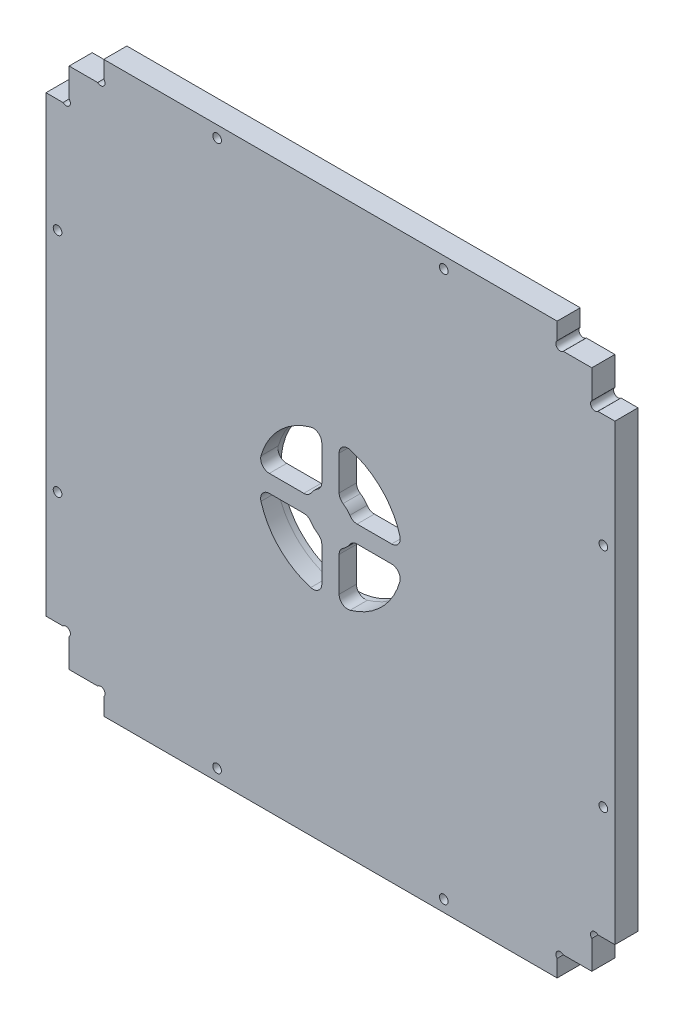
SolidWorks part; units mm, degrees
ref_plane "Plan de face" through (0, 0, 0) normal (0, 0, 1) x (1, 0, 0)
ref_plane "Plan de dessus" through (0, 0, 0) normal (0, 1, 0) x (1, 0, 0)
ref_plane "Plan de droite" through (0, 0, 0) normal (1, 0, 0) x (0, 0, -1)
sketch "Esquisse1" plane through (0, 0, 0) normal (0, 0, 1) x (1, 0, 0)
  line L0 (-102.032, 10.4842) -> (-102.032, -146.5158)
  line L1 (-279.032, 30.4842) -> (-229.032, 30.4842)
  line L2 (-299.032, -146.5158) -> (-299.032, 10.4842)
  line L3 (-279.032, -166.5158) -> (-229.032, -166.5158)
  line L4 (-299.032, -68.0158) -> (-291.032, 10.4842) construction
  line L6 (-299.032, -68.0158) -> (-291.032, -146.5158) construction
  line L7 (-122.032, 30.4842) -> (-122.032, 24.6055)
  line L8 (-102.032, -68.0158) -> (-110.032, 10.4842) construction
  line L9 (-119.9106, 22.4842) -> (-110.032, 22.4842)
  line L10 (-110.032, 22.4842) -> (-110.032, 12.6055)
  line L11 (-107.9106, 10.4842) -> (-102.032, 10.4842)
  line L12 (-279.032, 30.4842) -> (-279.032, 24.6055)
  line L13 (-281.1533, 22.4842) -> (-291.032, 22.4842)
  line L14 (-291.032, 22.4842) -> (-291.032, 12.6055)
  line L15 (-293.1533, 10.4842) -> (-299.032, 10.4842)
  line L16 (-299.032, -146.5158) -> (-293.1533, -146.5158)
  line L17 (-291.032, -148.6371) -> (-291.032, -158.5158)
  line L18 (-291.032, -158.5158) -> (-281.1533, -158.5158)
  line L19 (-279.032, -160.6371) -> (-279.032, -166.5158)
  line L20 (-122.032, -166.5158) -> (-122.032, -160.6371)
  line L21 (-119.9106, -158.5158) -> (-110.032, -158.5158)
  line L22 (-110.032, -158.5158) -> (-110.032, -148.6371)
  line L23 (-107.9106, -146.5158) -> (-102.032, -146.5158)
  line L24 (-102.032, -68.0158) -> (-110.032, -146.5158) construction
  line L25 (-299.032, -68.0158) -> (-102.032, -68.0158) construction
  line L26 (-200.532, -166.5158) -> (-122.032, -158.5158) construction
  line L27 (-200.532, -166.5158) -> (-279.032, -158.5158) construction
  line L28 (-200.532, 30.4842) -> (-122.032, 22.4842) construction
  line L29 (-200.532, 30.4842) -> (-279.032, 22.4842) construction
  line L30 (-279.032, 22.4842) -> (-292.5776, 36.0299) construction
  line L31 (-291.032, 10.4842) -> (-304.278, 23.7302) construction
  line L33 (-122.032, 22.4842) -> (-105.5635, 38.9527) construction
  line L34 (-110.032, 10.4842) -> (-87.3899, 33.1263) construction
  line L35 (-110.032, -146.5158) -> (-79.4717, -177.076) construction
  line L36 (-122.032, -158.5158) -> (-95.0538, -185.494) construction
  line L37 (-279.032, -158.5158) -> (-300.8456, -180.3295) construction
  line L38 (-291.032, -146.5158) -> (-319.2909, -174.7747) construction
  line L44 (-229.032, 30.4842) -> (-122.032, 30.4842)
  line L69 (-229.032, -166.5158) -> (-122.032, -166.5158)
  circle A0 centre (-239.782, 26.4842) radius 1.5
  circle A1 centre (-161.282, 26.4842) radius 1.5
  circle A2 centre (-106.032, -28.7658) radius 1.5
  circle A3 centre (-106.032, -107.2658) radius 1.5
  circle A4 centre (-161.282, -162.5158) radius 1.5
  circle A5 centre (-239.782, -162.5158) radius 1.5
  circle A6 centre (-295.032, -107.2658) radius 1.5
  circle A7 centre (-295.032, -28.7658) radius 1.5
  arc A8 (-281.1533, 22.4842) -> (-279.032, 24.6055) centre (-280.0926, 23.5449) ccw
  arc A9 (-293.1533, 10.4842) -> (-291.032, 12.6055) centre (-292.0926, 11.5449) ccw
  arc A10 (-122.032, 24.6055) -> (-119.9106, 22.4842) centre (-120.9713, 23.5449) ccw
  arc A11 (-110.032, 12.6055) -> (-107.9106, 10.4842) centre (-108.9713, 11.5449) ccw
  arc A12 (-107.9106, -146.5158) -> (-110.032, -148.6371) centre (-108.9713, -147.5764) ccw
  arc A13 (-119.9106, -158.5158) -> (-122.032, -160.6371) centre (-120.9713, -159.5764) ccw
  arc A14 (-279.032, -160.6371) -> (-281.1533, -158.5158) centre (-280.0926, -159.5764) ccw
  arc A15 (-291.032, -148.6371) -> (-293.1533, -146.5158) centre (-292.0926, -147.5764) ccw
  dimension "D7" = 45
  dimension "D13" = 8
  dimension "D15" = 20
  dimension "D16" = 45
  dimension "D4" = 45
  dimension "D6" = 8
  dimension "D3" = 45
  dimension "D5" = 45
  dimension "D8" = 20
  dimension "D9" = 8
  dimension "D10" = 8
  dimension "D11" = 45
  dimension "D12" = 20
  dimension "D14" = 8
  dimension "D17" = 8
  dimension "D18" = 20
  dimension "D19" = 45
  dimension "D20" = 8
  dimension "D21" = 8
  dimension "D22" = 45
extrude "Boss.-Extru.1" add sketch "Esquisse1" along normal blind 8
sketch "Esquisse2" plane through (0, 0, 8) normal (0, 0, 1) x (1, 0, 0)
  line L1 (-203.532, -75.432) -> (-203.532, -92.8351)
  line L2 (-197.577, -71.0158) -> (-197.532, -71.0158)
  line L3 (-203.532, -43.1964) -> (-203.532, -60.5996)
  line L4 (-197.532, -75.432) -> (-197.532, -92.8351)
  line L5 (-197.532, -43.1964) -> (-197.532, -60.5996)
  line L6 (-225.3513, -65.0158) -> (-207.9482, -65.0158)
  line L7 (-193.1158, -71.0158) -> (-175.7126, -71.0158)
  line L8 (-225.3513, -71.0158) -> (-207.9482, -71.0158)
  line L9 (-197.532, -71.0158) -> (-197.532, -71.0615)
  line L10 (-203.532, -64.9701) -> (-203.532, -65.0158)
  line L11 (-203.532, -65.0158) -> (-203.487, -65.0158)
  line L12 (-193.1158, -65.0158) -> (-175.7126, -65.0158)
  line L13 (-122.032, 30.4842) -> (-279.032, 30.4842) construction
  line L14 (-299.032, 10.4842) -> (-299.032, -146.5158) construction
  arc A0 (-225.3513, -71.0158) -> (-203.532, -92.8351) centre (-200.532, -68.0158) ccw
  arc A1 (-207.9482, -71.0158) -> (-203.532, -75.432) centre (-200.532, -68.0158) ccw
  arc A2 (-203.532, -60.5996) -> (-207.9482, -65.0158) centre (-200.532, -68.0158) ccw
  arc A3 (-193.1158, -65.0158) -> (-197.532, -60.5996) centre (-200.532, -68.0158) ccw
  arc A4 (-197.532, -75.432) -> (-193.1158, -71.0158) centre (-200.532, -68.0158) ccw
  arc A5 (-203.532, -43.1964) -> (-225.3513, -65.0158) centre (-200.532, -68.0158) ccw
  arc A6 (-175.7126, -65.0158) -> (-197.532, -43.1964) centre (-200.532, -68.0158) ccw
  arc A7 (-197.532, -92.8351) -> (-175.7126, -71.0158) centre (-200.532, -68.0158) ccw
  dimension "D1" = 3
  dimension "D2" = 3
  dimension "D3" = 3
  dimension "D4" = 3
  dimension "D5" = 98.5
  dimension "D6" = 98.5
extrude "Enlèv. mat.-Extru.1" cut sketch "Esquisse2" against normal through all
fillet "Congé1" radius 3 16 edges at (-203.532, -92.8351, 4) (-175.7126, -71.0158, 4) (-175.7126, -65.0158, 4) (-203.532, -75.432, 4) (-207.9482, -71.0158, 4) (-225.3513, -71.0158, 4) (-197.532, -75.432, 4) (-193.1158, -71.0158, 4) (-197.532, -92.8351, 4) (-193.1158, -65.0158, 4) (-197.532, -60.5996, 4) (-197.532, -43.1964, 4) (-203.532, -43.1964, 4) (-203.532, -60.5996, 4) (-207.9482, -65.0158, 4) (-225.3513, -65.0158, 4)
sketch "Esquisse3" plane through (0, 0, 0) normal (0, 0, -1) x (-1, 0, 0)
  circle A0 centre (200.532, -68.0158) radius 25.1
extrude "Enlèv. mat.-Extru.2" cut sketch "Esquisse3" against normal blind 2
sketch "Esquisse4" plane through (0, 0, 0) normal (0, 0, -1) x (-1, 0, 0)
  circle A0 centre (200.532, -68.0158) radius 27
  circle A1 centre (200.532, -41.0158) radius 1
  circle A2 centre (227.532, -68.0158) radius 1
  circle A3 centre (200.532, -95.0158) radius 1
  circle A4 centre (173.532, -68.0158) radius 1
extrude "Enlèv. mat.-Extru.3" cut sketch "Esquisse4" against normal blind 6 contours A0 A4 | A0 A4 | A0 A1 | A0 A1 | A0 A2 | A0 A2 | A0 A3 | A0 A3
